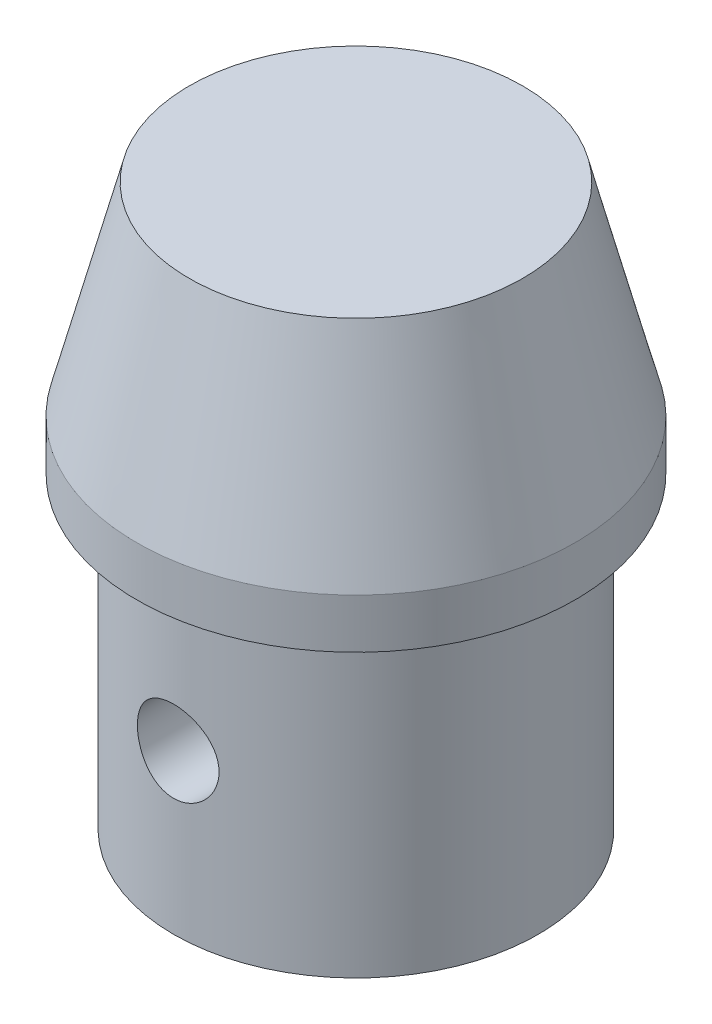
SolidWorks part; units mm, degrees
ref_plane "front" through (0, 0, 0) normal (0, 0, 1) x (1, 0, 0)
ref_plane "top" through (0, 0, 0) normal (0, 1, 0) x (1, 0, 0)
ref_plane "side" through (0, 0, 0) normal (1, 0, 0) x (0, 0, -1)
sketch "Sketch1" plane through (0, 0, 0) normal (0, 0, 1) x (1, 0, 0)
  line L0 (0, 0) -> (7.2898, 0)
  line L1 (50, 0) -> (-50, 0) construction
  line L2 (7.2898, 0) -> (7.2898, 12.319)
  line L3 (7.2898, 12.319) -> (8.763, 12.319)
  line L4 (8.763, 12.319) -> (8.763, 14.3002)
  line L5 (8.763, 14.3002) -> (6.6675, 22.4028)
  line L6 (6.6675, 22.4028) -> (0, 22.4028)
  line L7 (0, -50) -> (0, 50) construction
  line L8 (0, 22.4028) -> (0, 0)
  line L9 (0, 0) -> (0, 60.5546) construction
  dimension "D1" = 14.5796
  dimension "D2" = 17.526
  dimension "D3" = 13.335
  dimension "D4" = 22.4028
  dimension "D5" = 12.319
  dimension "D6" = 1.9812
revolve "Revolve1" add sketch "Sketch1" angle 360 about L9
sketch "Sketch2" plane through (0, 0, 0) normal (0, 0, 1) x (1, 0, 0)
  circle A0 centre (0, 6.3437) radius 1.6319
extrude "Cut-Extrude1" cut sketch "Sketch2" against normal mid plane 40.64
